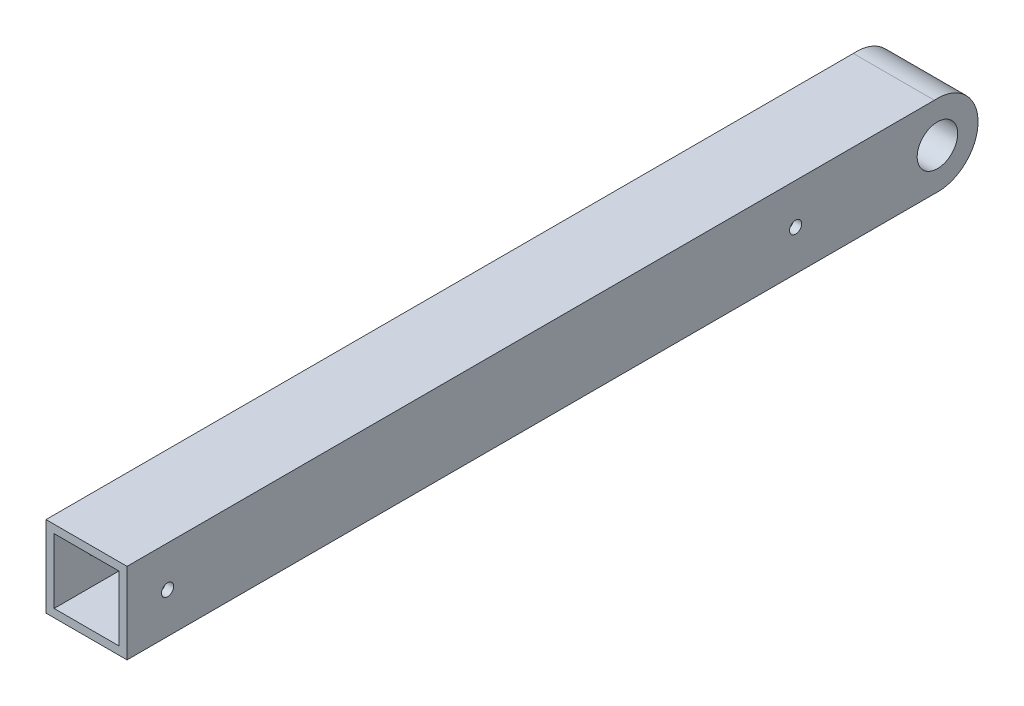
SolidWorks part; units mm, degrees
ref_plane "Plan de face" through (0, 0, 0) normal (0, 0, 1) x (1, 0, 0)
ref_plane "Plan de dessus" through (0, 0, 0) normal (0, 1, 0) x (1, 0, 0)
ref_plane "Plan de droite" through (0, 0, 0) normal (1, 0, 0) x (0, 0, -1)
sketch "Esquisse1" plane through (0, 0, 0) normal (0, 0, 1) x (1, 0, 0)
  line L1 (0, 0) -> (-20, 0)
  line L2 (0, 0) -> (0, 20)
  line L3 (0, 20) -> (-20, 20)
  line L4 (-20, 0) -> (-20, 20)
  dimension "D1" = 20
  dimension "D2" = 20
extrude "Boss.-Extru.1" add sketch "Esquisse1" along normal blind 200 contours L3 L4 L1 L2
sketch "Esquisse2" plane through (0, 0, 0) normal (1, 0, 0) x (0, 0, -1)
  line L0 (0, 0) -> (0, 20) construction
  circle A0 centre (0, 10) radius 10.0287
extrude "Boss.-Extru.2" add sketch "Esquisse2" against normal up to surface (20 mm away) contours A0
sketch "Esquisse3" plane through (0, 0, 0) normal (1, 0, 0) x (0, 0, -1)
  circle A0 centre (0, 10) radius 5
  arc A1 (-0.7578, 0) -> (-0.7578, 20) centre (0, 10) ccw construction
  dimension "D1" = 10
extrude "Enlèv. mat.-Extru.1" cut sketch "Esquisse3" against normal through all contours A0
sketch "Esquisse4" plane through (0, 0, 200) normal (0, 0, 1) x (1, 0, 0)
  line L0 (0, 20) -> (-20, 20) construction
  line L1 (-2, 18) -> (-18, 18)
  line L2 (-2, 18) -> (-2, 2)
  line L3 (-2, 2) -> (-18, 2)
  line L4 (-18, 18) -> (-18, 2)
  line L5 (0, 0) -> (0, 20) construction
  line L6 (0, 0) -> (-20, 0) construction
  line L7 (-20, 0) -> (-20, 20) construction
  dimension "D1" = 2
  dimension "D2" = 2
  dimension "D3" = 2
  dimension "D4" = 2
extrude "Enlèv. mat.-Extru.2" cut sketch "Esquisse4" against normal blind 170 contours L3 L4 L1 L2
sketch "Esquisse5" plane through (0, 0, 0) normal (1, 0, 0) x (0, 0, -1)
  line L0 (-200, 0) -> (-0.7578, 0) construction
  circle A0 centre (-35, 10) radius 1.5
  circle A1 centre (0, 10) radius 5 construction
  dimension "D1" = 35
  dimension "D2" = 3
  dimension "D3" = 10
extrude "Enlèv. mat.-Extru.3" cut sketch "Esquisse5" against normal through all
sketch "Esquisse6" plane through (0, 0, 0) normal (1, 0, 0) x (0, 0, -1)
  line L0 (-200, 0) -> (-0.7578, 0) construction
  line L1 (-200, 0) -> (-200, 20) construction
  circle A0 centre (-190, 10) radius 1.5
  dimension "D1" = 3
  dimension "D2" = 10
  dimension "D3" = 10
extrude "Enlèv. mat.-Extru.4" cut sketch "Esquisse6" against normal through all
